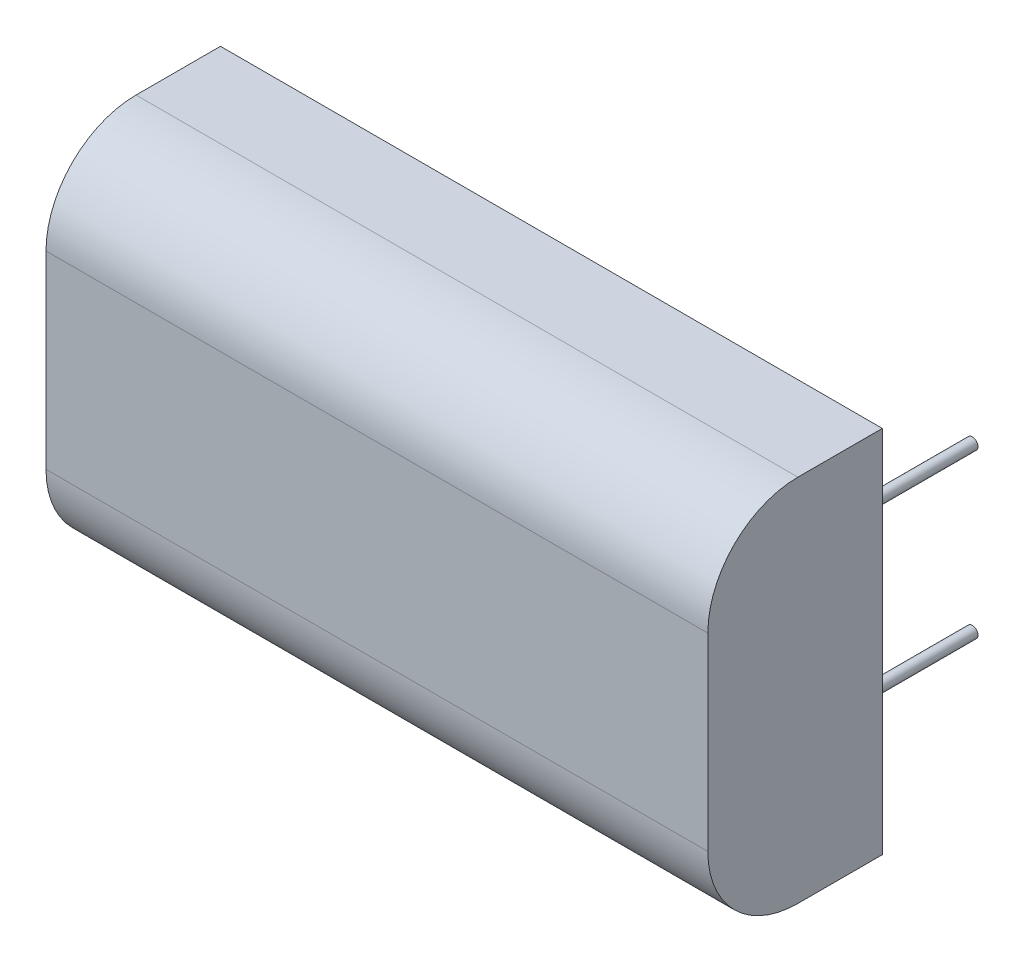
SolidWorks part; units mm, degrees
ref_plane "Front Plane" through (0, 0, 0) normal (0, 0, 1) x (1, 0, 0)
ref_plane "Top Plane" through (0, 0, 0) normal (0, 1, 0) x (1, 0, 0)
ref_plane "Right Plane" through (0, 0, 0) normal (1, 0, 0) x (0, 0, -1)
sketch "Sketch1" plane through (0, 0, 0) normal (1, 0, 0) x (0, 0, -1)
  line L1 (7.75, -16.4) -> (-7.75, -16.4)
  line L2 (7.75, -16.4) -> (7.75, 16.4)
  line L3 (7.75, 16.4) -> (-7.75, 16.4)
  line L4 (-7.75, -16.4) -> (-7.75, 16.4)
  line L5 (7.75, -16.4) -> (-7.75, 16.4) construction
  line L6 (7.75, 16.4) -> (-7.75, -16.4) construction
  point P0 (0, 0)
  dimension "D1" = 15.5
  dimension "D2" = 32.8
extrude "Boss-Extrude1" add sketch "Sketch1" along normal mid plane 58.8
fillet "Fillet1" radius 8 2 edges at (0, -16.4, 7.75) (0, 16.4, 7.75)
sketch "Sketch2" plane through (0, 0, -7.75) normal (0, 0, -1) x (-1, 0, 0)
  line L0 (-25.4, 16.4) -> (-25.4, -16.4) construction
  line L1 (-29.4, 16.4) -> (29.4, 16.4) construction
  line L2 (-29.4, -16.4) -> (29.4, -16.4) construction
  line L3 (-29.4, -16.4) -> (-29.4, 16.4) construction
  line L4 (-31.6502, 0) -> (31.6117, 0) construction
  line L5 (8.525, 0) -> (-8.525, 0) construction
  circle A0 centre (-25.4, 7.25) radius 0.5
  circle A1 centre (-25.4, -7.25) radius 0.5
  point P17 (0, 0)
  dimension "D2" = 1
  dimension "D1" = 4
  dimension "D3" = 14.5
extrude "Boss-Extrude2" add sketch "Sketch2" along normal blind 12 contours A0
